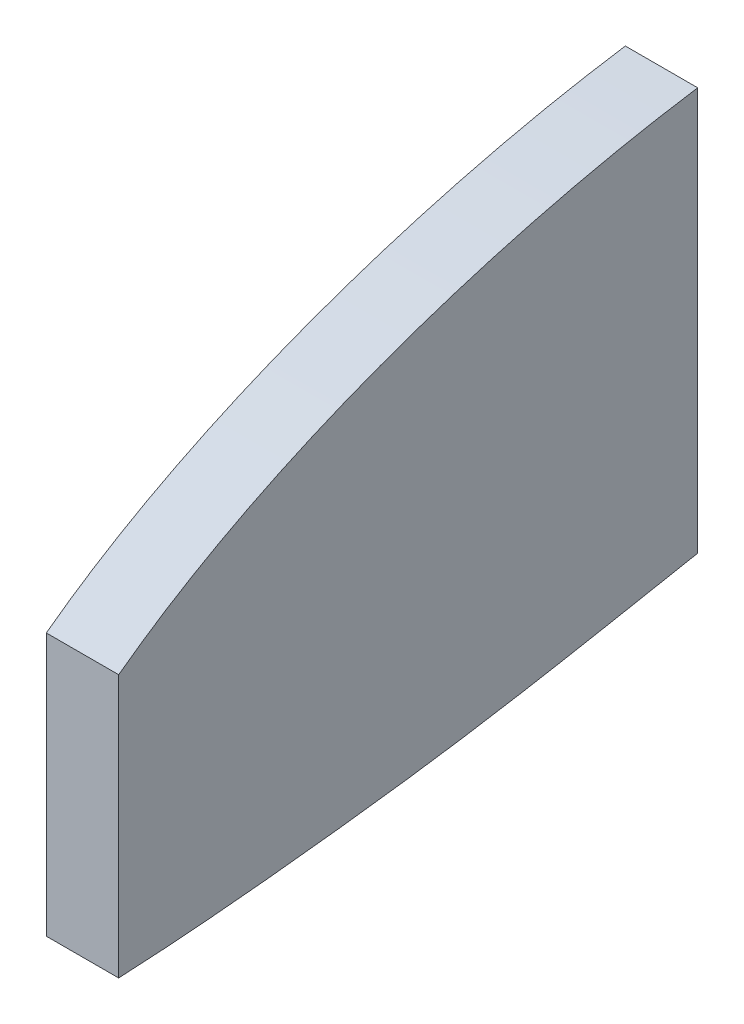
SolidWorks part; units mm, degrees
ref_plane "Front Plane" through (0, 0, 0) normal (0, 0, 1) x (1, 0, 0)
ref_plane "Top Plane" through (0, 0, 0) normal (0, 1, 0) x (1, 0, 0)
ref_plane "Right Plane" through (0, 0, 0) normal (1, 0, 0) x (0, 0, -1)
curve "Curve1"
sketch "Sketch1" plane through (0, 0, 0) normal (1, 0, 0) x (0, 0, -1)
  line L1 (0, 0) -> (0, 95.7684) construction
  line L2 (6.35, 9.3114) -> (6.35, -2.2105)
  line L3 (31.75, 18.9087) -> (31.75, 1.2273)
  spline S0 degree 3 poles (31.75, 18.9087) (30.8282, 18.7681) (28.6506, 18.394) (25.298, 17.6485) (21.7622, 16.6729) (18.4462, 15.5708) (15.3642, 14.3678) (12.5354, 13.0705) (9.9687, 11.7051) (7.9333, 10.4453) (6.7708, 9.6244) (6.35, 9.3114) knots 1.383512 1.383512 1.383512 1.383512 1.392653 1.40517 1.417172 1.428604 1.439419 1.449597 1.459102 1.467908 1.473049 1.473049 1.473049 1.473049
  spline S1 degree 3 poles (6.35, -2.2105) (6.4866, -2.2038) (7.5655, -2.1482) (9.7294, -2.0053) (12.9698, -1.707) (16.6023, -1.3031) (20.609, -0.785) (24.9881, -0.0604) (28.7373, 0.6535) (31.0395, 1.0921) (31.75, 1.2273) knots 0.536375 0.536375 0.536375 0.536375 0.537716 0.546968 0.557637 0.56962 0.582804 0.597247 0.613135 0.620227 0.620227 0.620227 0.620227
  dimension "D2" = 6.35
  dimension "D3" = 31.75
extrude "Boss-Extrude1" add sketch "Sketch1" along normal blind 3.175
